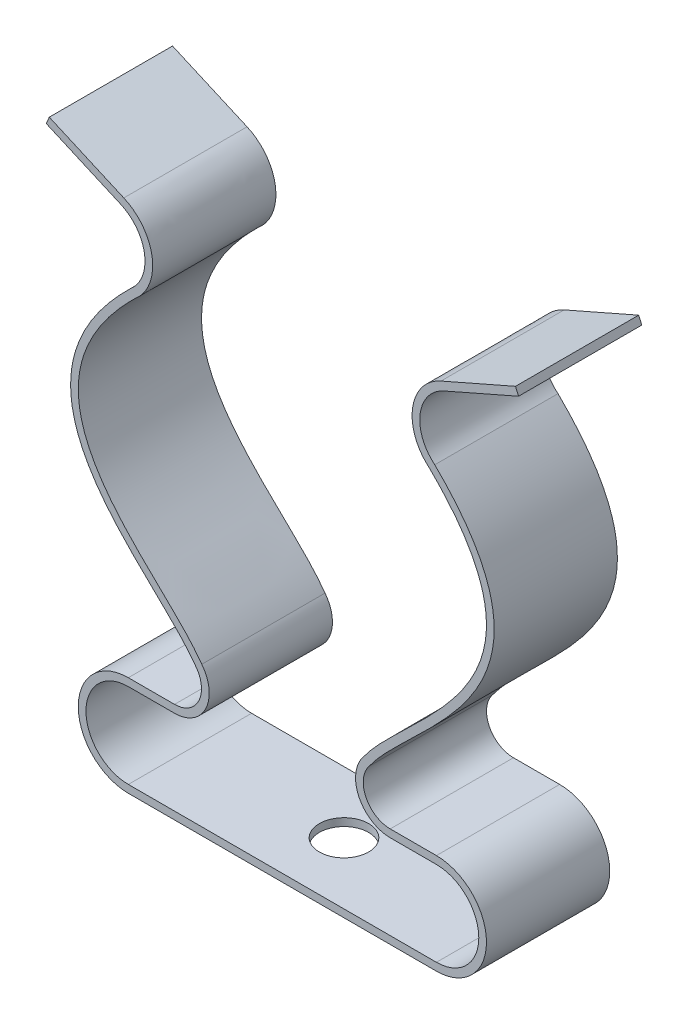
SolidWorks part; units mm, degrees
ref_plane "Plan de face" through (0, 0, 0) normal (0, 0, 1) x (1, 0, 0)
ref_plane "Plan de dessus" through (0, 0, 0) normal (0, 1, 0) x (1, 0, 0)
ref_plane "Plan de droite" through (0, 0, 0) normal (1, 0, 0) x (0, 0, -1)
sketch "Esquisse1" plane through (0, 0, 0) normal (0, 0, 1) x (1, 0, 0)
  line L0 (-7.3629, 0) -> (35.8646, 0) construction
  line L1 (0, -11.0444) -> (0, 50.7092) construction
  line L2 (-7.3629, 35) -> (35.8646, 35) construction
  line L3 (13, -11.0444) -> (13, 46.9505) construction
  line L4 (5, -4.3191) -> (5, 10.9808) construction
  line L5 (8.525, 28.0445) -> (8.525, 40.9628) construction
  line L6 (18.3012, 3) -> (9.1926, 3) construction
  line L7 (10, 6.2117) -> (10, -0.6704) construction
  line L8 (8, 44.1437) -> (8, 13.7375) construction
  line L9 (0, 0) -> (10, 0)
  line L10 (-3.999, 17) -> (24.6296, 17) construction
  line L11 (20.9352, 6) -> (-0.7267, 6) construction
  line L12 (7, 9.1544) -> (7, 4.8198) construction
  line L13 (4.3236, 8) -> (16.334, 8) construction
  line L14 (7, 6) -> (10, 6)
  line L17 (15.2323, 34.9694) -> (10.3938, 32.8467)
  arc A0 (10, 0) -> (10, 6) centre (10, 3) ccw
  arc A2 (5.4301, 9.2392) -> (7, 6) centre (7, 8) ccw
  arc A3 (10.3938, 32.8467) -> (9.7237, 27.9806) centre (11.5514, 30.2081) ccw
  spline S0 degree 3 poles (5.4301, 9.2392) (8.4902, 13.5115) (19.069, 18.8589) (9.7237, 27.9806) knots 0 0 0 0 1 1 1 1
  dimension "D9" = 6
  dimension "D1" = 35
  dimension "D2" = 3
  dimension "D3" = 13
  dimension "D4" = 5
  dimension "D5" = 8.525
  dimension "D6" = 8
  dimension "D7" = 3
  dimension "D8" = 17
  dimension "D10" = 2
  dimension "D11" = 2
sketch "Esquisse2" plane through (0, 0, 0) normal (1, 0, 0) x (0, 0, -1)
  line L0 (5.3483, 0) -> (-5.7875, 0) construction
  line L1 (5.3483, 0) -> (2.4921, 0) construction
  line L2 (-4.4548, -0.25) -> (8.2191, -0.25) construction
  line L3 (-4.4548, 0.25) -> (8.2191, 0.25) construction
  line L4 (4, 0.7506) -> (4, -4.5062) construction
  line L5 (-4, 0.7506) -> (-4, -4.5062) construction
  line L6 (0, -1.2189) -> (0, 0.7837) construction
  line L8 (-4, 0.25) -> (4, 0.25)
  line L9 (-4, 0.25) -> (-4, -0.25)
  line L10 (-4, -0.25) -> (4, -0.25)
  line L11 (4, 0.25) -> (4, -0.25)
  dimension "D1" = 4
  dimension "D2" = 0.25
  dimension "D3" = 8
  dimension "D4" = 0.5
sweep "Balayage1" add profiles "Esquisse2" path "Esquisse1"
mirror "Symétrie1" about plane through (0, -0.25, 4) normal (1, 0, 0) of "Balayage1"
sketch "Esquisse3" plane through (0, 0.25, 0) normal (0, 1, 0) x (-1, 0, 0)
  circle A0 centre (0, 0) radius 1.6
extrude "Enlèv. mat.-Extru.1" cut sketch "Esquisse3" against normal blind 2
